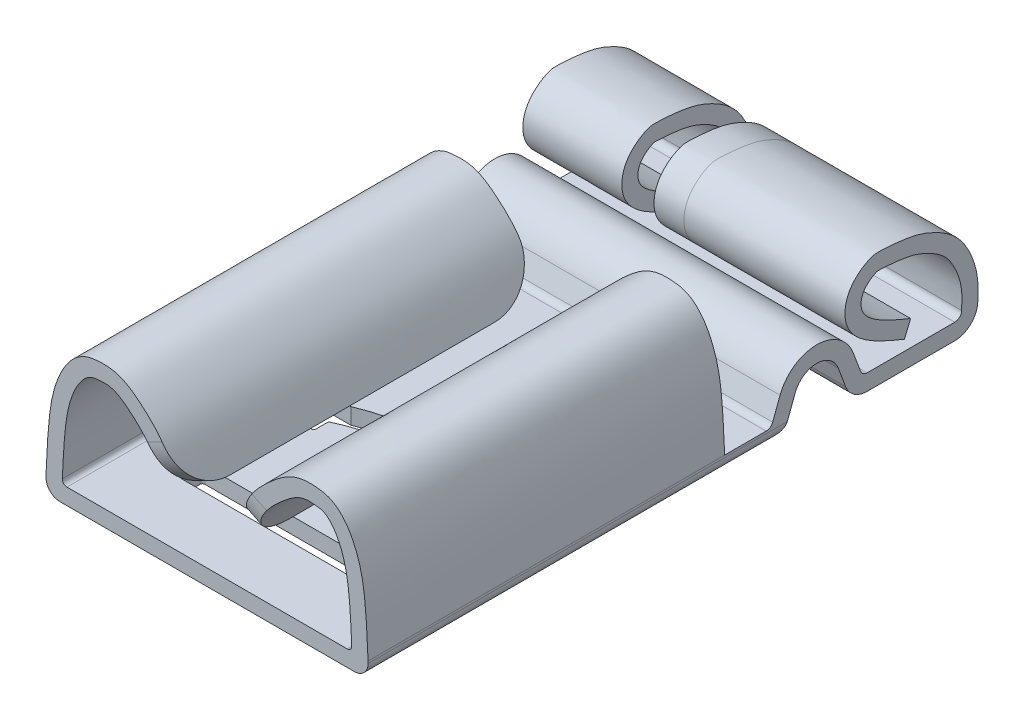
SolidWorks part; units mm, degrees
ref_plane "Plan de face" through (0, 0, 0) normal (0, 0, 1) x (1, 0, 0)
ref_plane "Plan de dessus" through (0, 0, 0) normal (0, 1, 0) x (1, 0, 0)
ref_plane "Plan de droite" through (0, 0, 0) normal (1, 0, 0) x (0, 0, -1)
sketch "Esquisse1" plane through (0, 0, 0) normal (0, 0, 1) x (1, 0, 0)
  line L0 (0.8144, 1.1962) -> (0.5, 1.35)
  line L1 (3.1503, 0.3345) -> (3.5, 0.35)
  spline S0 degree 3 poles (3.5, 0.35) (3.486, 0.6659) (3.4563, 1.3375) (3.3239, 2.3313) (2.8473, 3.0037) (2.0871, 3.0962) (1.8477, 3.0565) (1.1134, 2.448) (0.8722, 2.1106) (0.6098, 1.5744) (0.5, 1.35) knots 0 0 0 0 0.162898 0.346347 0.525763 0.525763 0.704901 0.704901 0.876545 1 1 1 1
  spline S1 degree 1 poles (3.1503, 0.3345) (0.8144, 1.1962) knots 0 0 1 1 construction
  spline S2 degree 3 poles (3.1503, 0.3345) (3.1398, 0.5736) (3.117, 1.0584) (3.068, 1.6303) (2.9699, 2.0381) (2.8479, 2.3412) (2.6765, 2.5864) (2.5378, 2.6818) (2.4063, 2.7073) (2.1784, 2.7228) (2.0413, 2.6982) (1.8547, 2.608) (1.6127, 2.4082) (1.4231, 2.233) (1.2746, 2.0587) (1.0943, 1.7665) (0.9176, 1.4072) (0.8144, 1.1962) knots 0 0 0 0 0.125 0.25 0.3125 0.375 0.4375 0.5 0.53125 0.5625 0.625 0.6875 0.71875 0.75 0.8125 0.875 1 1 1 1
  dimension "D6" = 0.35
extrude "Extrusion1" add sketch "Esquisse1" along normal blind 7.75
sketch "Esquisse2" plane through (0, 0, 7.75) normal (0, 0, 1) x (1, 0, 0)
  line L0 (3.5, 0.35) -> (3.1525, 0.3348)
  line L1 (0, 0) -> (3.5, 0)
  line L2 (3.5, 0) -> (3.5, 0.35)
  line L3 (0, 0) -> (0, 0.35)
  line L4 (0, 0.35) -> (3.1525, 0.35)
  line L5 (3.1525, 0.35) -> (3.1525, 0.3348)
  dimension "D1" = 0.35
extrude "Extrusion2" add sketch "Esquisse2" against normal blind 7.75
sketch "Esquisse3" plane through (0, 0, 0) normal (0, 0, -1) x (-1, 0, 0)
  line L1 (0, 0.35) -> (-3.5, 0.35)
  line L2 (0, 0.35) -> (0, 0)
  line L3 (0, 0) -> (-3.5, 0)
  line L4 (-3.5, 0.35) -> (-3.5, 0)
sketch "Esquisse4" plane through (0, 0, 0) normal (1, 0, 0) x (0, 0, -1)
  line L0 (0, 0) -> (0.9035, 0)
  line L1 (1.3717, 0.3244) -> (1.5318, 0.7516)
  line L2 (2.4682, 0.7516) -> (2.6283, 0.3244)
  line L3 (3.0965, 0) -> (5.0016, 0)
  line L4 (0, 0.35) -> (0, 3.066) construction
  arc A0 (0.9035, 0) -> (1.3717, 0.3244) centre (0.9035, 0.5) ccw
  arc A1 (2.6283, 0.3244) -> (3.0965, 0) centre (3.0965, 0.5) ccw
  arc A2 (1.5318, 0.7516) -> (2.4682, 0.7516) centre (2, 0.576) cw
  arc A3 (5.0016, 0) -> (5.5013, 0.4849) centre (5.0016, 0.5) ccw
  spline S0 degree 3 poles (5.5013, 0.4849) (5.5054, 0.6182) (5.5203, 0.9454) (5.3889, 1.4092) (5.138, 1.8577) (4.7607, 2.1828) (4.3949, 2.338) (3.9849, 2.4649) (3.5135, 2.5102) (3.1421, 2.4931) (2.6579, 2.2007) (2.5087, 1.1552) (3.3161, 0.8209) (3.9075, 0.576) knots 0.071519 0.071519 0.071519 0.071519 0.130402 0.215742 0.28108 0.354179 0.437269 0.437269 0.578573 0.578573 0.674371 0.761509 1 1 1 1
  point P9 (1.25, 0)
  point P12 (2.75, 0)
  point P15 (2, 2)
  dimension "D6" = 0.5
  dimension "D7" = 0.5
  dimension "D8" = 0.5
  dimension "D1" = 2.5
  dimension "D9" = 0.5
  dimension "D2" = 2
  dimension "D3" = 2
  dimension "D4" = 1.25
  dimension "D5" = 1.5
sweep "Balayage1" add profiles "Esquisse3" path "Esquisse4"
fillet "Congé1" radius 1 2 edges at (0.6572, 1.2731, 7.75) (0.6572, 1.2731, 0)
mirror "Symétrie6" about plane through (0, 0, 0) normal (1, 0, 0) of "Extrusion2", "Extrusion1"
mirror "Symétrie7" about plane through (0, 0, 0) normal (1, 0, 0) of "Congé1", "Extrusion1"
mirror "Symétrie8" about plane through (0, 0, 0) normal (1, 0, 0) of "Balayage1"
ref_plane "Plan1" through (-1, 0, 0) normal (-1, 0, 0) x (0, 0, 1)
sketch "Esquisse5" plane through (-1, 0, 0) normal (-1, 0, 0) x (0, 0, 1)
  line L1 (-3.0965, 0.35) -> (-5.0016, 0.35) construction
  line L2 (-5.956, 0.35) -> (-5.956, 2.1337)
  line L3 (-5.956, 2.1337) -> (-3.8452, 2.6614)
  line L4 (-4.5719, 0.35) -> (-3.2848, 0.6948)
  line L5 (-4.5719, 0.35) -> (-4.5719, -0.1522)
  line L6 (-4.5719, -0.1522) -> (-5.956, -0.1522)
  line L7 (-5.956, -0.1522) -> (-5.956, 0.35)
  arc A0 (-3.2848, 0.6948) -> (-3.8452, 2.6614) centre (-3.5494, 1.6825) ccw
extrude "Enlèv. mat.-Extru.1" cut sketch "Esquisse5" against normal mid plane 0.7
fillet "Congé2" radius 0.3 2 edges at (-3.5, 0, 3.4233) (3.5, 0, 3.4233)
fillet "Congé3" radius 0.1 2 edges at (-3.1497, 0.35, 3.875)
sketch "Esquisse6" plane through (0, 0, 0) normal (0, -1, 0) x (1, 0, 0)
  line L0 (2, 3.2002) -> (2, 3.95)
  line L1 (1.95, 6.3491) -> (-1.95, 6.3491)
  line L2 (2, 6.2991) -> (2, 5.8991)
  line L3 (1.95, 5.8491) -> (-1.95, 5.8491)
  line L4 (-2, 6.2991) -> (-2, 5.8991)
  line L5 (1.95, 3.1502) -> (1.4845, 3.1502)
  line L6 (1.95, 4) -> (1.4821, 4)
  line L7 (1.4321, 3.95) -> (1.4321, 3.7119)
  line L8 (0, 3.3491) -> (0, 2.5328) construction
  line L9 (-1.4321, 3.95) -> (-1.4321, 3.7119)
  line L10 (-1.95, 4) -> (-1.4821, 4)
  line L11 (-1.95, 3.1502) -> (-1.4845, 3.1502)
  line L12 (-2, 3.2002) -> (-2, 3.95)
  arc A0 (1.95, 6.3491) -> (2, 6.2991) centre (1.95, 6.2991) cw
  arc A1 (2, 5.8991) -> (1.95, 5.8491) centre (1.95, 5.8991) cw
  arc A2 (-1.95, 6.3491) -> (-2, 6.2991) centre (-1.95, 6.2991) ccw
  arc A3 (-1.95, 5.8491) -> (-2, 5.8991) centre (-1.95, 5.8991) cw
  arc A4 (-1.4036, 3.6668) -> (1.4036, 3.6668) centre (0, 6.6087) ccw
  arc A5 (-1.4651, 3.1463) -> (1.4651, 3.1463) centre (0, 6.6087) ccw
  arc A6 (2, 3.2002) -> (1.95, 3.1502) centre (1.95, 3.2002) cw
  arc A7 (2, 3.95) -> (1.95, 4) centre (1.95, 3.95) ccw
  arc A8 (1.4821, 4) -> (1.4321, 3.95) centre (1.4821, 3.95) ccw
  arc A9 (1.4321, 3.7119) -> (1.4036, 3.6668) centre (1.3821, 3.7119) cw
  arc A10 (1.4651, 3.1463) -> (1.4845, 3.1502) centre (1.4845, 3.1002) cw
  arc A11 (-1.4321, 3.7119) -> (-1.4036, 3.6668) centre (-1.3821, 3.7119) ccw
  arc A12 (-1.4321, 3.95) -> (-1.4821, 4) centre (-1.4821, 3.95) ccw
  arc A13 (-1.95, 4) -> (-2, 3.95) centre (-1.95, 3.95) ccw
  arc A14 (-1.95, 3.1502) -> (-2, 3.2002) centre (-1.95, 3.2002) cw
  arc A15 (-1.4845, 3.1502) -> (-1.4651, 3.1463) centre (-1.4845, 3.1002) cw
  point P7 (2, 6.3491)
  point P10 (2, 5.8491)
  point P13 (-2, 6.3491)
  point P18 (0, 3.3491)
  point P20 (0, 2.8491)
  point P33 (2, 3.1502)
  point P36 (2, 4)
  point P39 (1.4321, 4)
  point P42 (1.4321, 3.6805)
  point P45 (1.4744, 3.1502)
  point P48 (-1.4321, 3.6805)
  point P51 (-1.4321, 4)
  point P54 (-2, 4)
  point P57 (-2, 3.1502)
  point P60 (-1.4744, 3.1502)
  dimension "D4" = 0.05
  dimension "D8" = 0.05
  dimension "D12" = 3.2596
  dimension "D1" = 0.5
  dimension "D2" = 2
  dimension "D3" = 4
  dimension "D5" = 3
  dimension "D6" = 0.5
  dimension "D7" = 2
  dimension "D9" = 2.8491
  dimension "D10" = 0.8498
  dimension "D11" = 4
  dimension "D13" = 1.4321
extrude "Enlèv. mat.-Extru.2" cut sketch "Esquisse6" against normal blind 1
